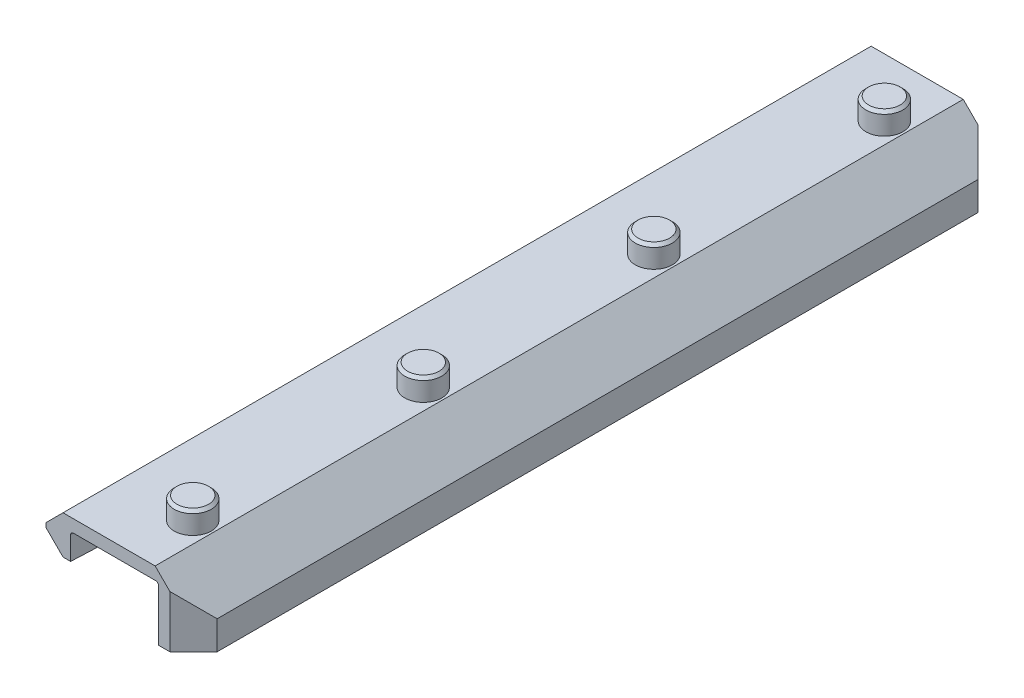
SolidWorks part; units mm, degrees
ref_plane "Front Plane" through (0, 0, 0) normal (0, 0, 1) x (1, 0, 0)
ref_plane "Top Plane" through (0, 0, 0) normal (0, 1, 0) x (1, 0, 0)
ref_plane "Right Plane" through (0, 0, 0) normal (1, 0, 0) x (0, 0, -1)
sketch "Sketch1" plane through (0, 0, 0) normal (0, 0, 1) x (1, 0, 0)
  line L0 (-7.62, 4.5) -> (4.7498, 4.5)
  line L1 (-9.906, -4.5) -> (9.906, -4.5) construction
  line L2 (-9.906, -4.5) -> (-9.906, 4.5) construction
  line L3 (-9.906, 4.5) -> (9.906, 4.5) construction
  line L4 (9.906, -4.5) -> (9.906, 4.5) construction
  line L5 (-9.906, -4.5) -> (9.906, 4.5) construction
  line L6 (-9.906, 4.5) -> (9.906, -4.5) construction
  line L7 (9.906, -0.6562) -> (9.906, -4.5)
  line L8 (9.906, -4.5) -> (4.699, -4.5)
  line L9 (4.699, -4.5) -> (4.699, 2.8236)
  line L10 (4.699, 2.8236) -> (-6.096, 2.8236)
  line L11 (-6.096, 2.8236) -> (-6.096, -0.6562)
  line L12 (-6.096, -0.6562) -> (-7.62, -0.6562)
  line L13 (-9.906, 1.6298) -> (-9.906, 2.214)
  line L14 (4.7498, 4.5) -> (9.906, -0.6562)
  line L15 (-9.906, 2.214) -> (-7.62, 4.5)
  line L16 (-7.62, -0.6562) -> (-9.906, 1.6298)
  point P0 (0, 0)
  point P11 (-9.906, -0.6562)
  point P22 (4.699, -4.5)
  dimension "D1" = 9
  dimension "D2" = 19.812
  dimension "D3" = 1.6764
  dimension "D4" = 5.207
  dimension "D5" = 3.81
  dimension "D6" = 5.1562
extrude "Boss-Extrude1" add sketch "Sketch1" along normal blind 108.5342
chamfer "Chamfer1" distance 11.0998 distance2 0.508 2 edges at (4.699, -0.8382, 108.5342) (-6.096, 1.0837, 108.5342)
chamfer "Chamfer2" distance 0.508 distance2 11.0998 2 edges at (4.699, -0.8382, 0) (-6.096, 1.0837, 0)
chamfer "Chamfer3" distance 3.175 angle 45 2 edges at (9.906, -2.5781, 0) (9.906, -2.5781, 108.5342)
sketch "Sketch2" plane through (0, 4.5, 0) normal (0, 1, 0) x (1, 0, 0)
  line L0 (1.9812, 0.0003) -> (1.9812, -108.5342) construction
  line L4 (9.906, -105.3592) -> (9.906, -3.175) construction
  line L5 (-9.906, -54.2671) -> (9.906, -54.2671) construction
  line L6 (-9.906, -108.5342) -> (-9.906, 0) construction
  circle A0 centre (1.9812, -7.8232) radius 2.4892
  circle A1 centre (1.9812, -38.7858) radius 2.4892
  circle A2 centre (1.9812, -69.7484) radius 2.4892
  circle A3 centre (1.9812, -100.711) radius 2.4892
  dimension "D5" = 4.9784
  dimension "D1" = 7.9248
  dimension "D2" = 30.9626
  dimension "D3" = 30.9626
  dimension "D4" = 30.9626
extrude "Boss-Extrude2" add sketch "Sketch2" along normal blind 2.921
chamfer "Chamfer4" distance 0.381 angle 45 4 edges at (1.9812, 7.421, 103.2002) (1.9812, 7.421, 72.2376) (1.9812, 7.421, 41.275) (1.9812, 7.421, 10.3124)
fillet "Fillet1" radius 0.381 6 edges at (4.699, 2.8236, 54.2671) (-6.096, 2.8236, 54.2671) (4.953, 2.8236, 5.5499) (-6.35, 2.8236, 5.5499) (-6.35, 2.8236, 102.9843) (4.953, 2.8236, 102.9843)
